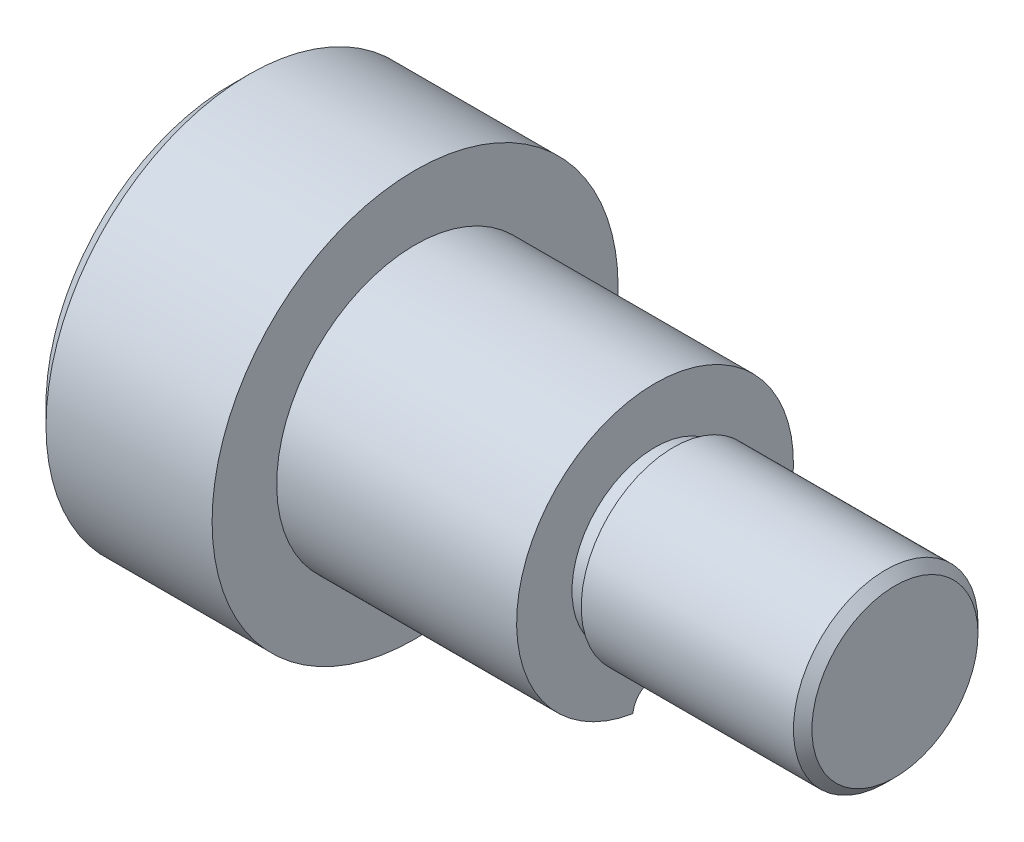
SolidWorks part; units mm, degrees
ref_plane "Face" through (0, 0, 0) normal (0, 0, 1) x (1, 0, 0)
ref_plane "Dessus" through (0, 0, 0) normal (0, 1, 0) x (1, 0, 0)
ref_plane "Droite" through (0, 0, 0) normal (1, 0, 0) x (0, 0, -1)
sketch "Esquisse1" plane through (0, 0, 0) normal (1, 0, 0) x (0, 0, -1)
  circle A0 centre (0, 0) radius 11
  dimension "D1" = 22
extrude "Extrusion1" add sketch "Esquisse1" along normal blind 10
sketch "Esquisse2" plane through (10, 0, 0) normal (1, 0, 0) x (0, 0, -1)
  circle A0 centre (0, 0) radius 7.5
  dimension "D1" = 15
extrude "Extrusion2" add sketch "Esquisse2" along normal blind 13
sketch "Esquisse3" plane through (23, 0, 0) normal (1, 0, 0) x (0, 0, -1)
  circle A0 centre (0, 0) radius 4.5
  dimension "D1" = 9
extrude "Extrusion3" add sketch "Esquisse3" along normal blind 1
sketch "Esquisse4" plane through (24, 0, 0) normal (1, 0, 0) x (0, 0, -1)
  circle A0 centre (0, 0) radius 5
  dimension "D1" = 10
extrude "Extrusion4" add sketch "Esquisse4" along normal blind 12
chamfer "Chanfrein1" distance 0.5 angle 45 1 edges at (36, 0, -5)
chamfer "Chanfrein2" distance 1 angle 45 1 edges at (0, 0, -11)
hole_wizard "Dégagement M21" positions "Esquisse7" profile "Esquisse6" hole size "M2" standard "ISO"
sketch "Esquisse7" plane through (23, 0, 0) normal (1, 0, 0) x (0, 0, -1)
  circle A0 centre (0, 0) radius 7.5 construction
  point P0 (0, -7.5)
sketch "Esquisse6" plane through (23, -7.5, 0) normal (0, 1, 0) x (0, 0, -1)
  line L0 (0, 0) -> (0, 6.721)
  line L1 (0, 6.721) -> (1.2, 6)
  line L2 (1.2, 6) -> (1.2, 0)
  line L5 (1.2, 0) -> (0, 0)
  line L10 (0, 6.721) -> (-1.2, 6) construction
  line L11 (0, -6.35) -> (0, 107.95) construction
  dimension "Diamètre du perçage" = 2.4
  dimension "Profondeur du perçage" = 6
  dimension "Angle de pointe" = 118
